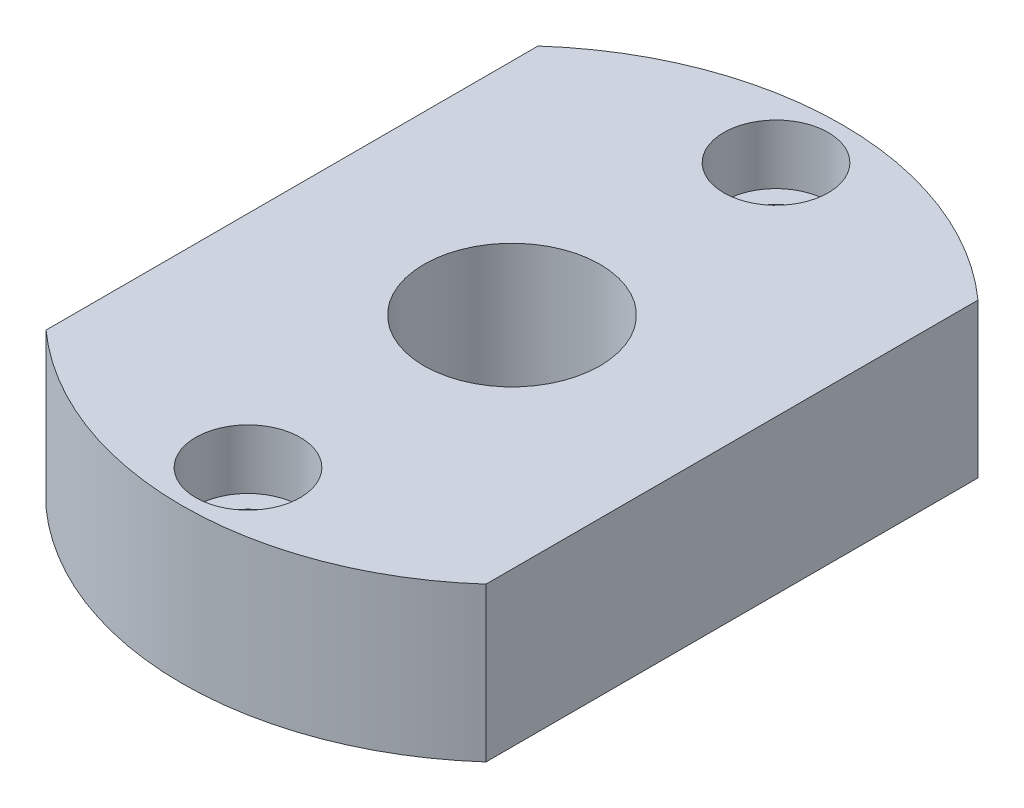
SolidWorks part; units mm, degrees
ref_plane "前视基准面" through (0, 0, 0) normal (0, 0, 1) x (1, 0, 0)
ref_plane "上视基准面" through (0, 0, 0) normal (0, 1, 0) x (1, 0, 0)
ref_plane "右视基准面" through (0, 0, 0) normal (1, 0, 0) x (0, 0, -1)
other "Configuration Table"
sketch "草图1" plane through (0, 0, 0) normal (0, 1, 0) x (1, 0, 0)
  circle A0 centre (0, 0) radius 30
  dimension "D1" = 60
extrude "凸台-拉伸1" add sketch "草图1" along normal blind 14
sketch "草图2" plane through (0, 14, 0) normal (0, 1, 0) x (1, 0, 0)
  circle A0 centre (0, 0) radius 8
  dimension "D1" = 16
extrude "切除-拉伸1" cut sketch "草图2" against normal blind 14
sketch "草图3" plane through (0, 14, 0) normal (0, 1, 0) x (1, 0, 0)
  line L0 (30, 0) -> (-30, 0) construction
  circle A0 centre (0, 24) radius 3
  circle A1 centre (0, 0) radius 30 construction
  circle A2 centre (0, -24) radius 3
  dimension "D1" = 6
  dimension "D2" = 24
extrude "切除-拉伸2" cut sketch "草图3" against normal blind 14
sketch "草图4" plane through (0, 14, 0) normal (0, 1, 0) x (1, 0, 0)
  circle A0 centre (0, 24) radius 4.75
  circle A1 centre (0, -24) radius 4.75
  dimension "D1" = 9.5
  dimension "D2" = 9.5
extrude "切除-拉伸3" cut sketch "草图4" against normal blind 5.4
sketch "草图5" plane through (0, 14, 0) normal (0, 1, 0) x (1, 0, 0)
  line L1 (-20, -32.5) -> (20, -32.5)
  line L2 (-20, -32.5) -> (-20, 32.5)
  line L3 (-20, 32.5) -> (20, 32.5)
  line L4 (20, -32.5) -> (20, 32.5)
  line L5 (-20, -32.5) -> (20, 32.5) construction
  line L6 (-20, 32.5) -> (20, -32.5) construction
  point P0 (0, 0)
  dimension "D1" = 40
  dimension "D2" = 65
extrude "切除-拉伸4" cut sketch "草图5" against normal blind 14 flip side to cut
